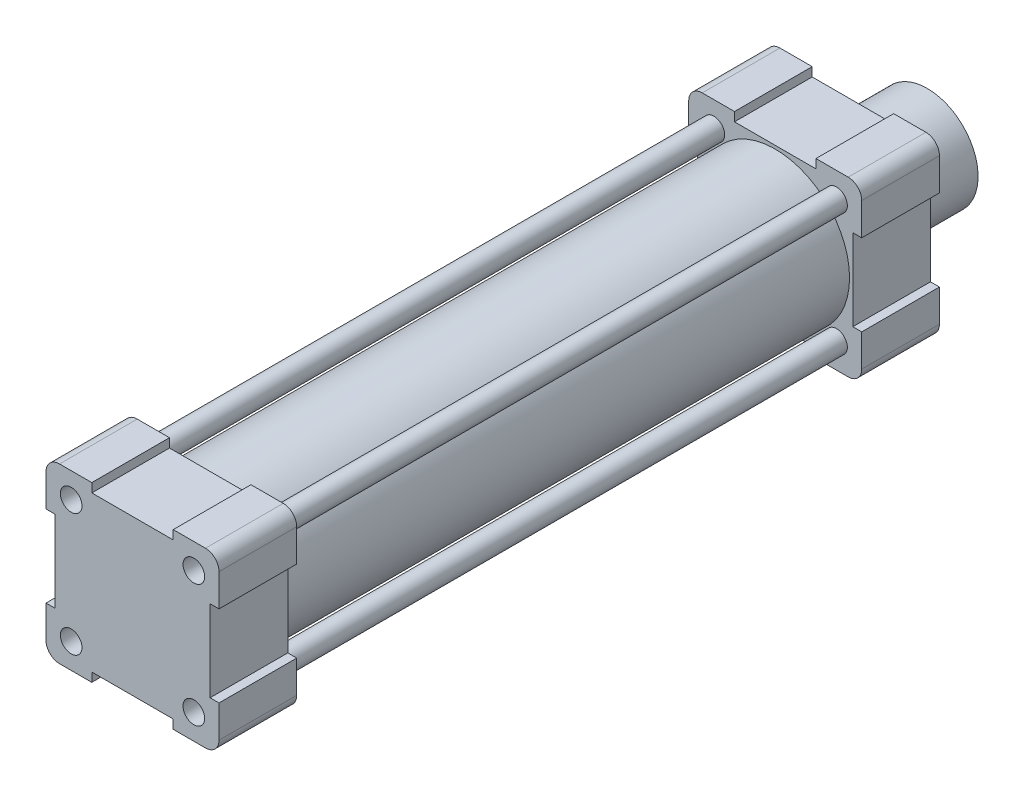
SolidWorks part; units mm, degrees
ref_plane "Front" through (0, 0, 0) normal (0, 0, 1) x (1, 0, 0)
ref_plane "Top" through (0, 0, 0) normal (0, 1, 0) x (1, 0, 0)
ref_plane "Right" through (0, 0, 0) normal (1, 0, 0) x (0, 0, -1)
sketch "Sketch1" plane through (0, 0, 0) normal (0, 0, 1) x (1, 0, 0)
  line L1 (-26.69, -26.69) -> (26.69, -26.69) construction
  line L2 (-26.69, -26.69) -> (-26.69, 26.69) construction
  line L3 (-26.69, 26.69) -> (26.69, 26.69) construction
  line L4 (26.69, -26.69) -> (26.69, 26.69) construction
  line L5 (-26.69, -26.69) -> (26.69, 26.69) construction
  line L6 (-26.69, 26.69) -> (26.69, -26.69) construction
  circle A0 centre (0, 0) radius 27.5
  point P0 (0, 0)
  dimension "D3" = 55
  dimension "D1" = 53.38
  dimension "D2" = 53.38
extrude "Boss-Extrude3" add sketch "Sketch1" along normal blind 209 contours A0
sketch "Sketch3" plane through (0, 0, 209) normal (0, 0, 1) x (1, 0, 0)
  line L0 (-15.065, 32) -> (-27, 32)
  line L1 (27, -32) -> (15.065, -32)
  line L2 (32, -27) -> (32, -15.065)
  line L3 (27, 32) -> (15.065, 32)
  line L4 (-32, -27) -> (-32, -15.065)
  line L5 (32, -32) -> (-32, 32) construction
  line L6 (32, 32) -> (-32, -32) construction
  line L7 (-32, 15.065) -> (-32, 27)
  line L8 (-15.065, 32) -> (-15.065, 28.69)
  line L9 (-15.065, 28.69) -> (15.065, 28.69)
  line L10 (15.065, 32) -> (15.065, 28.69)
  line L11 (-32, -15.065) -> (-28.69, -15.065)
  line L12 (32, 15.065) -> (32, 27)
  line L13 (-32, 15.065) -> (-28.69, 15.065)
  line L14 (-28.69, -15.065) -> (-28.69, 15.065)
  line L15 (32, 15.065) -> (28.69, 15.065)
  line L16 (-15.065, -32) -> (-27, -32)
  line L17 (32, -15.065) -> (28.69, -15.065)
  line L18 (28.69, 15.065) -> (28.69, -15.065)
  line L20 (-15.065, -32) -> (-15.065, -28.69)
  line L21 (-15.065, -28.69) -> (15.065, -28.69)
  line L22 (15.065, -32) -> (15.065, -28.69)
  arc A0 (-32, 27) -> (-27, 32) centre (-27, 27) cw
  arc A1 (32, 27) -> (27, 32) centre (27, 27) ccw
  arc A2 (27, -32) -> (32, -27) centre (27, -27) ccw
  arc A3 (-32, -27) -> (-27, -32) centre (-27, -27) ccw
  circle A4 centre (-22.69, 22.69) radius 4
  circle A5 centre (22.69, 22.69) radius 4
  circle A6 centre (22.69, -22.69) radius 4
  circle A7 centre (-22.69, -22.69) radius 4
  point P0 (0, 0)
  point P10 (0, 28.69)
  point P23 (-28.69, 0)
  point P24 (0, -28.69)
  point P25 (28.69, 0)
  dimension "D11" = 5
  dimension "D12" = 5
  dimension "D13" = 5
  dimension "D14" = 5
  dimension "D15" = 8
  dimension "D16" = 45.38
  dimension "D1" = 64
  dimension "D2" = 64
  dimension "D3" = 3.31
  dimension "D4" = 30.13
  dimension "D5" = 3.31
  dimension "D6" = 3.31
  dimension "D7" = 3.31
  dimension "D8" = 30.13
  dimension "D9" = 30.13
  dimension "D10" = 30.13
extrude "Boss-Extrude4" add sketch "Sketch3" along normal blind 28.75
ref_plane "Plane1" through (0, 0, 104.5) normal (0, 0, -1) x (-1, 0, 0)
mirror "Mirror1" about plane through (0, 0, 104.5) normal (0, 0, -1)
sketch "Sketch6" plane through (0, 0, -28.75) normal (0, 0, -1) x (-1, 0, 0)
  circle A0 centre (0, 0) radius 18.8
  dimension "D1" = 37.6
extrude "Boss-Extrude7" add sketch "Sketch6" along normal blind 27.5
sketch "Sketch7" plane through (0, 0, -56.25) normal (0, 0, -1) x (-1, 0, 0)
  circle A0 centre (0, 0) radius 10.025
  dimension "D1" = 20.05
extrude "Cut-Extrude1" cut sketch "Sketch7" against normal blind 146
sketch "Sketch8" plane through (0, 0, 104.5) normal (0, 0, -1) x (-1, 0, 0)
  circle A0 centre (-22.69, 22.69) radius 4 construction
  circle A1 centre (22.69, 22.69) radius 4 construction
  circle A2 centre (22.69, -22.69) radius 4 construction
  circle A3 centre (-22.69, -22.69) radius 4 construction
  circle A4 centre (-22.69, 22.69) radius 4
  circle A5 centre (22.69, 22.69) radius 4
  circle A6 centre (22.69, -22.69) radius 4
  circle A7 centre (-22.69, -22.69) radius 4
extrude "Boss-Extrude8" add sketch "Sketch8" along normal up to surface (209 mm away) from surface at -104.5 separate body
